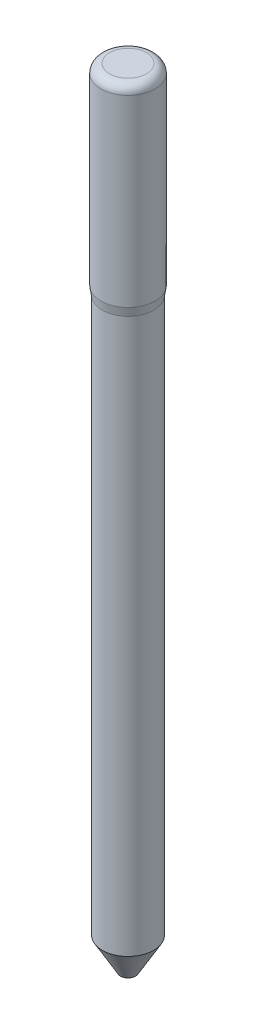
SolidWorks part; units mm, degrees
ref_plane "Front Plane" through (0, 0, 0) normal (0, 0, 1) x (1, 0, 0)
ref_plane "Top Plane" through (0, 0, 0) normal (0, 1, 0) x (1, 0, 0)
ref_plane "Right Plane" through (0, 0, 0) normal (1, 0, 0) x (0, 0, -1)
sketch "Sketch1" plane through (0, 0, 0) normal (0, 0, 1) x (1, 0, 0)
  line L0 (0, 0) -> (0, 26.0851) construction
  line L1 (0, 0) -> (0.2154, 0)
  line L2 (0.2154, 0) -> (0.735, 0.9)
  line L3 (0.735, 0.9) -> (0.735, 16.75)
  line L5 (0.775, 17) -> (0.775, 22.25)
  line L6 (0.525, 22.5) -> (0, 22.5)
  line L7 (0, 22.5) -> (0, 0)
  line L8 (0.775, 17) -> (0.735, 16.75)
  arc A0 (0.775, 22.25) -> (0.525, 22.5) centre (0.525, 22.25) ccw
  dimension "D7" = 0.25
  dimension "D1" = 1.47
  dimension "D2" = 30
  dimension "D3" = 0.9
  dimension "D4" = 1.55
  dimension "D5" = 22.5
  dimension "D6" = 5.5
  dimension "D8" = 0.25
revolve "Revolve1" add sketch "Sketch1" angle 360 about L0
